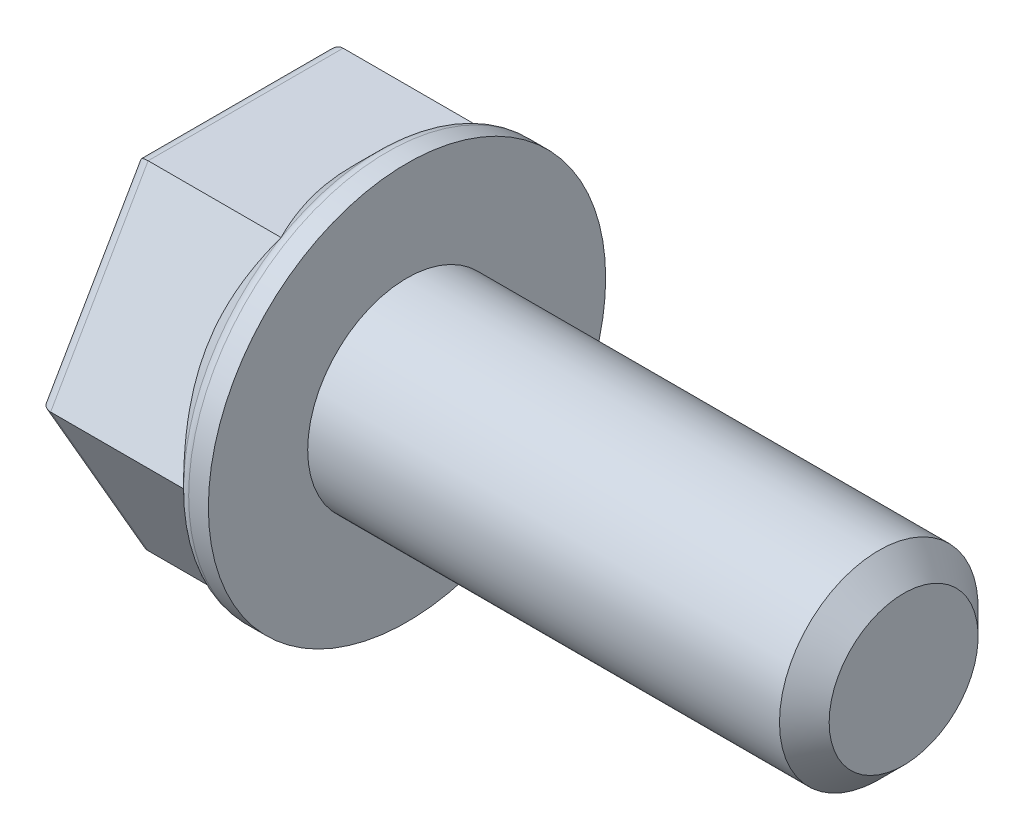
SolidWorks part; units mm, degrees
ref_plane "Plane1" through (0, 0, 0) normal (0, 0, 1) x (1, 0, 0)
ref_plane "Plane2" through (0, 0, 0) normal (0, 1, 0) x (1, 0, 0)
ref_plane "Plane3" through (0, 0, 0) normal (1, 0, 0) x (0, 0, -1)
sketch "Esquisse1" plane through (0, 0, 0) normal (0, 0, 1) x (1, 0, 0)
  line L0 (-16, 0) -> (50, 0) construction
  line L1 (-3.5, 0) -> (-3.5, 3)
  line L2 (-3.5, 3) -> (-1.5, 3)
  line L3 (-1.5, 3) -> (-0.5, 4)
  line L4 (-0.5, 4) -> (0, 4)
  line L5 (0, 4) -> (0, 2)
  line L6 (0, 2) -> (9.5, 2)
  line L7 (9.5, 2) -> (10, 1.5)
  line L8 (10, 1.5) -> (10, 0)
  line L9 (10, 0) -> (-3.5, 0)
revolve "Base-Révolution" add sketch "Esquisse1" angle 360 about L0
sketch "Esquisse2" plane through (-3.5, 0, 0) normal (-1, 0, 0) x (0, 0, 1)
  line L0 (-6, 0) -> (7, 0) construction
  line L1 (-3.926, 0) -> (-1.963, 3.4)
  line L2 (0, 0) -> (0, 8.5) construction
  line L3 (3.926, 0) -> (1.963, 3.4)
  line L4 (0, 3.4) -> (4.5636, 3.4) construction
  line L5 (1.963, 3.4) -> (-1.963, 3.4)
  line L6 (3.926, 0) -> (1.963, -3.4)
  line L7 (-3.926, 0) -> (-1.963, -3.4)
  line L8 (1.963, -3.4) -> (-1.963, -3.4)
  dimension "D1" = 60
  dimension "D2" = 3.4
extrude "Boss.-Extru.2" add sketch "Esquisse2" against normal up to surface (3.5 mm away)
sketch "Esquisse3" plane through (0, 0, 0) normal (0, 0, 1) x (1, 0, 0)
  line L0 (-3.0732, 2.5732) -> (-4.5, 4)
  line L2 (-2.9268, 2.2197) -> (-2.9268, 0)
  line L3 (-16, 0) -> (50, 0) construction
  line L4 (-2.9268, 0) -> (-4.5, 0)
  line L5 (-4.5, 0) -> (-4.5, 4)
  line L6 (-4.5, 0) -> (11.5, 0) construction
  arc A0 (-3.0732, 2.5732) -> (-2.9268, 2.2197) centre (-3.4268, 2.2197) cw
  dimension "D1" = 0.5
revolve "Enlever de la matière-Révolution1" cut sketch "Esquisse3" angle 360 about L6
fillet "Congé1" radius 0.25
fillet "Congé2" radius 0.25
